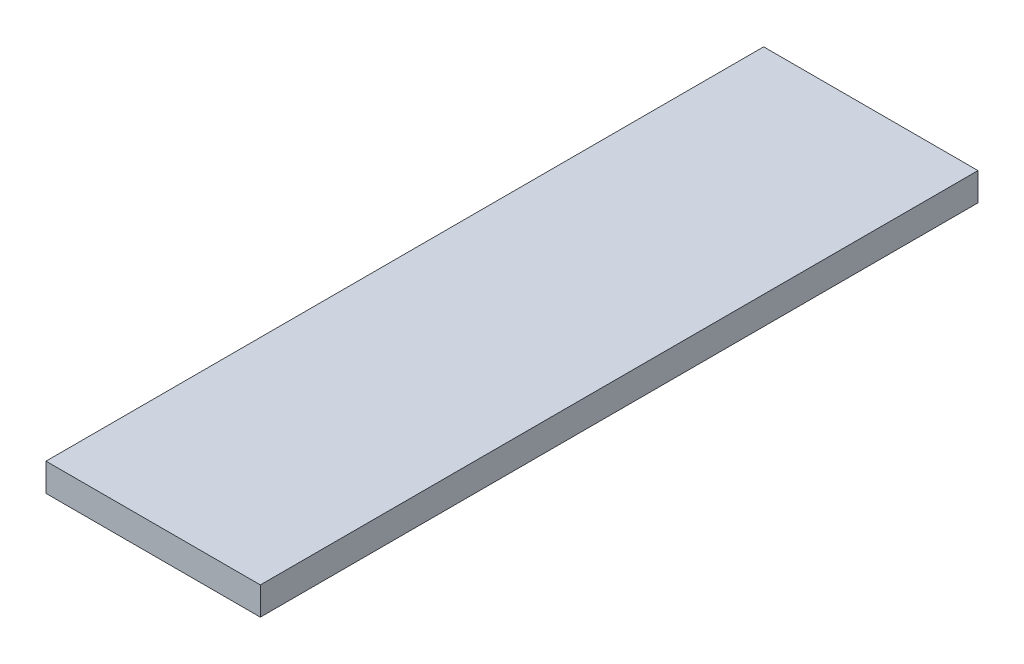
SolidWorks part; units mm, degrees
ref_plane "Front Plane" through (0, 0, 0) normal (0, 0, 1) x (1, 0, 0)
ref_plane "Top Plane" through (0, 0, 0) normal (0, 1, 0) x (1, 0, 0)
ref_plane "Right Plane" through (0, 0, 0) normal (1, 0, 0) x (0, 0, -1)
sketch "Sketch1" plane through (0, 0, 0) normal (0, 1, 0) x (1, 0, 0)
  line L0 (0, 0) -> (0, -977.9)
  line L1 (0, -977.9) -> (-292.1, -977.9)
  line L2 (-292.1, -977.9) -> (-292.1, 0)
  line L3 (-292.1, 0) -> (0, 0)
  dimension "D1" = 977.9
  dimension "D3" = 292.1
extrude "Boss-Extrude1" add sketch "Sketch1" along normal blind 38.1
